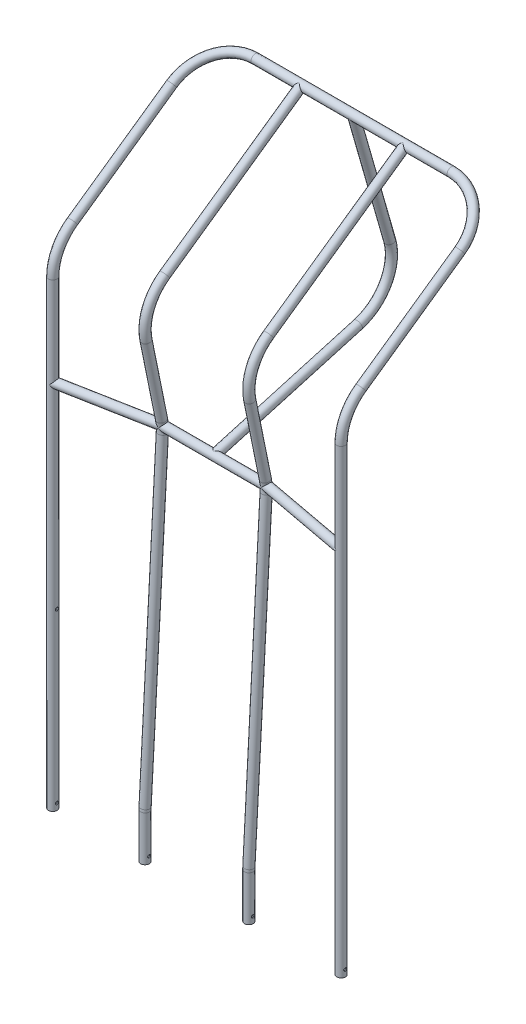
SolidWorks part; units mm, degrees
ref_plane "Front Plane" through (0, 0, 0) normal (0, 0, 1) x (1, 0, 0)
ref_plane "Top Plane" through (0, 0, 0) normal (0, 1, 0) x (1, 0, 0)
ref_plane "Right Plane" through (0, 0, 0) normal (1, 0, 0) x (0, 0, -1)
sketch3d "3DSketch1"
  line L1 (317.5, 0, 0) -> (-317.5, 0, 0) construction
  line L2 (317.5, 0, 0) -> (317.5, 1013.9104, 0)
  line L3 (317.5, 1066.8, 0) -> (-317.5, 1066.8, 0) construction
  line L4 (-317.5, 0, 0) -> (-317.5, 1013.9104, 0)
  line L6 (-317.5, 1097.1362, -43.3246) -> (-317.5, 1249.8246, -261.3863)
  line L7 (-215.9, 1308.1, -344.6121) -> (215.9, 1308.1, -344.6121)
  line L8 (317.5, 1097.1362, -43.3246) -> (317.5, 1249.8246, -261.3863)
  arc A0 (317.5, 1013.9104, 0) -> (317.5, 1097.1362, -43.3246) centre (317.5, 1013.9104, -101.6) ccw
  arc A1 (215.9, 1308.1, -344.6121) -> (317.5, 1249.8246, -261.3863) centre (215.9, 1249.8246, -261.3863) ccw
  arc A2 (-317.5, 1249.8246, -261.3863) -> (-215.9, 1308.1, -344.6121) centre (-215.9, 1249.8246, -261.3863) ccw
  arc A3 (-317.5, 1097.1362, -43.3246) -> (-317.5, 1013.9104, 0) centre (-317.5, 1013.9104, -101.6) ccw
  point P11 (317.5, 1066.8, 0)
  point P13 (215.9, 1013.9104, -101.6)
  point P16 (317.5, 1308.1, -344.6121)
  point P17 (215.9, 1166.5988, -319.6616)
  point P20 (-317.5, 1308.1, -344.6121)
  point P21 (-215.9, 1166.5988, -319.6616)
  point P24 (-317.5, 1066.8, 0)
  point P26 (-215.9, 1013.9104, -101.6)
  dimension "D5" = 101.6
  dimension "D1" = 635
  dimension "D2" = 1066.8
  dimension "D3" = 55
  dimension "D4" = 1308.1
ref_plane "offset_left" through (-114.3, 0, 0) normal (1, 0, 0) x (0, 0, -1)
ref_plane "offset_right" through (114.3, 0, 0) normal (1, 0, 0) x (0, 0, -1)
ref_plane "offset_up" through (0, 812.8, 0) normal (0, 1, 0) x (1, 0, 0)
sketch "Sketch2" plane through (-114.3, 0, 0) normal (1, 0, 0) x (0, 0, -1)
  line L0 (0, 0) -> (0, 1013.9104) construction
  line L1 (0, 0) -> (0, 98.827)
  line L2 (0.1513, 104.3688) -> (38.1391, 799.7757)
  line L3 (248.5622, 812.8) -> (-248.5622, 812.8) construction
  line L4 (36.249, 825.5816) -> (2.0413, 993.6463)
  line L5 (43.3246, 1097.1362) -> (344.6121, 1308.1)
  circle A0 centre (0, 520.7) radius 9.525
  arc A1 (2.0413, 993.6463) -> (43.3246, 1097.1362) centre (101.6, 1013.9104) cw
  arc A2 (43.3246, 1097.1362) -> (0, 1013.9104) centre (101.6, 1013.9104) ccw construction
  arc A3 (0, 98.827) -> (0.1513, 104.3688) centre (101.6, 98.827) cw
  arc A4 (38.1391, 799.7757) -> (36.249, 825.5816) centre (-63.3097, 805.3176) ccw
  point P21 (0, 101.6)
  point P24 (38.8506, 812.8)
  dimension "D1" = 19.05
  dimension "D2" = 520.7
  dimension "D5" = 101.6
  dimension "D3" = 101.6
  dimension "D4" = 13.335
sketch "Sketch3" plane through (114.3, 0, 0) normal (1, 0, 0) x (0, 0, -1)
  line L0 (0, 0) -> (0, 98.827) construction
  line L1 (0, 0) -> (0, 98.827)
  line L2 (0.1513, 104.3688) -> (38.1391, 799.7757)
  line L4 (36.249, 825.5816) -> (2.0413, 993.6463)
  line L5 (43.3246, 1097.1362) -> (344.6121, 1308.1)
  circle A0 centre (0, 520.7) radius 9.525
  arc A1 (2.0413, 993.6463) -> (43.3246, 1097.1362) centre (101.6, 1013.9104) cw
  arc A3 (0, 98.827) -> (0.1513, 104.3688) centre (101.6, 98.827) cw
  arc A4 (38.1391, 799.7757) -> (36.249, 825.5816) centre (-63.3097, 805.3176) ccw
  point P21 (0, 101.6)
  point P24 (38.8506, 812.8)
sketch "Sketch4" plane through (0, 812.8, 0) normal (0, 1, 0) x (1, 0, 0)
  line L0 (-317.5, 0) -> (-114.3, 38.0144)
  line L1 (-114.3, 38.0144) -> (114.3, 38.0144)
  line L2 (114.3, 38.0144) -> (317.5, 0)
sketch "Sketch5" plane through (0, 0, 0) normal (1, 0, 0) x (0, 0, -1)
  line L0 (38.0144, 812.8) -> (354.8884, 903.6621)
  line L1 (424.5478, 1029.3311) -> (344.6121, 1308.1)
  line L2 (43.3246, 1097.1362) -> (261.3863, 1249.8246) construction
  arc A0 (354.8884, 903.6621) -> (424.5478, 1029.3311) centre (326.8836, 1001.3263) ccw
  dimension "D3" = 101.6
  dimension "D1" = 90
  dimension "D2" = 71
other "Al round tubing 0.75 OD X 0.083 WALL(1)"
ref_plane "Plane1" through (317.5, 0, 0) normal (0, 1, 0) x (1, 0, 0)
sketch "Sketch1" plane through (317.5, 0, 0) normal (0, 1, 0) x (1, 0, 0)
  circle A0 centre (0, 0) radius 7.4168
  circle A1 centre (0, 0) radius 9.525
  point P3 (0, 0)
  dimension "In_dia" = 14.8336
  dimension "Out_dia" = 19.05
sketch "Sketch6" plane through (0, 0, 0) normal (1, 0, 0) x (0, 0, -1)
  circle A0 centre (0, 14.2875) radius 3.2639
  dimension "D1" = 6.5278
  dimension "D2" = 14.2875
extrude "Cut-Extrude1" cut sketch "Sketch6" against normal through all both and the other way through all
sketch "Sketch7" plane through (0, 0, 0) normal (1, 0, 0) x (0, 0, -1)
  line L0 (-35.9713, 0) -> (4.7625, 0)
  line L1 (9.525, 4.7625) -> (9.525, 66.9305)
  line L2 (9.525, 0) -> (9.525, 1013.9104) construction
  line L3 (4.7625, 0) -> (9.525, 4.7625)
  point P1 (9.525, 0)
extrude "Cut-Extrude2" cut sketch "Sketch7" against normal through all both and the other way through all flip side to cut
sketch "Sketch8" plane through (0, 0, 0) normal (1, 0, 0) x (0, 0, -1)
  line L0 (0, 384.175) -> (0, 0) construction
  circle A0 centre (0, 384.175) radius 3.3782
  dimension "D2" = 6.7564
  dimension "D1" = 384.175
extrude "Cut-Extrude3" cut sketch "Sketch8" against normal through all
equation "\"plane_offset\"=4.5"
equation "\"D1@offset_left\" = \"plane_offset\""
equation "\"D1@offset_right\" = \"plane_offset\""
